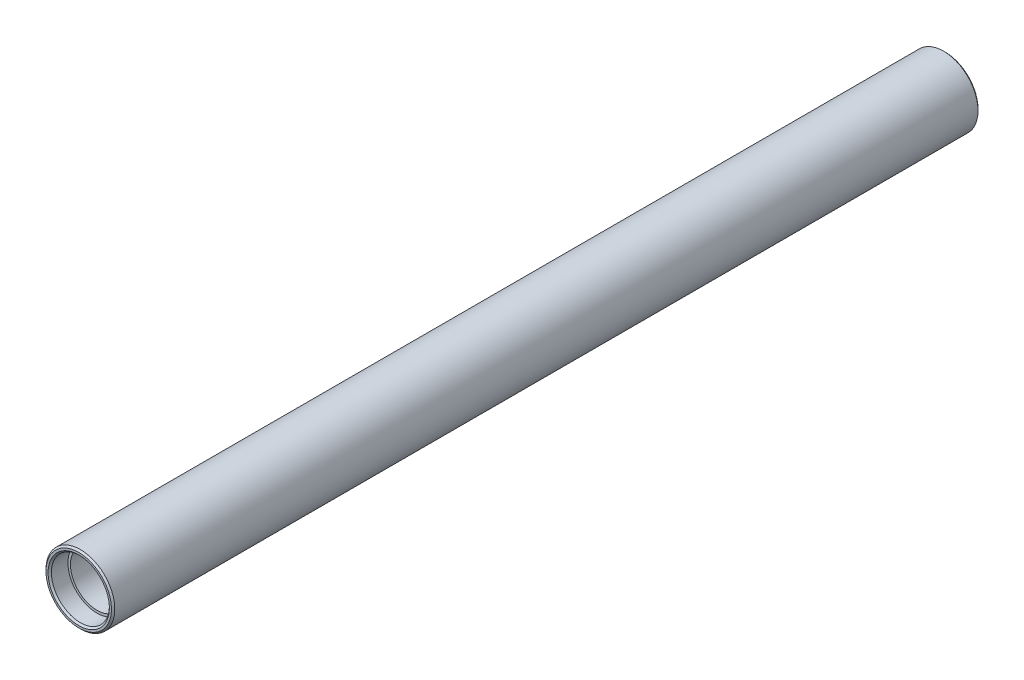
SolidWorks part; units mm, degrees
ref_plane "Plan de face" through (0, 0, 0) normal (0, 0, 1) x (1, 0, 0)
ref_plane "Plan de dessus" through (0, 0, 0) normal (0, 1, 0) x (1, 0, 0)
ref_plane "Plan de droite" through (0, 0, 0) normal (1, 0, 0) x (0, 0, -1)
sketch "Esquisse1" plane through (0, 0, 0) normal (0, 0, 1) x (1, 0, 0)
  circle A0 centre (0, 0) radius 20.75
  circle A1 centre (0, 0) radius 16
  dimension "D1" = 41.5
  dimension "D2" = 32
extrude "Extrusion1" add sketch "Esquisse1" along normal blind 261.5
sketch "Esquisse2" plane through (0, 0, 0) normal (0, 0, -1) x (-1, 0, 0)
  circle A0 centre (0, 0) radius 17.5
  dimension "D1" = 35
extrude "Enlèv. mat.-Extru.1" cut sketch "Esquisse2" against normal blind 11
chamfer "Chanfrein1" distance 1 angle 45 2 edges at (-17.5, 0, 0) (20.75, 0, 0)
mirror "Symétrie1" about plane through (0, 0, 261.5) normal (0, 0, 1) of "Enlèv. mat.-Extru.1", "Chanfrein1", "Extrusion1"
